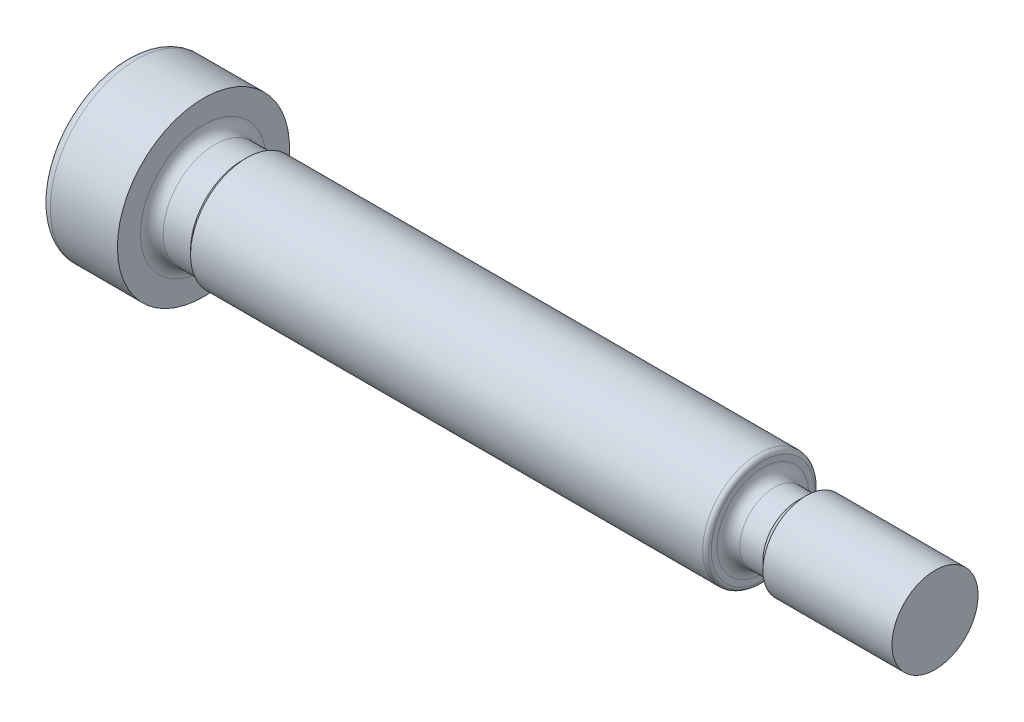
SolidWorks part; units mm, degrees
ref_plane "Front Plane" through (0, 0, 0) normal (0, 0, 1) x (1, 0, 0)
ref_plane "Top Plane" through (0, 0, 0) normal (0, 1, 0) x (1, 0, 0)
ref_plane "Right Plane" through (0, 0, 0) normal (1, 0, 0) x (0, 0, -1)
sketch "Sketch1" plane through (0, 0, 0) normal (0, 0, 1) x (1, 0, 0)
  line L0 (-180.4629, 0) -> (8842.6818, 0) construction
  line L1 (0, -180.4629) -> (0, 8842.6818) construction
  line L2 (0, 0) -> (0, 5)
  line L3 (0, 5) -> (4.5, 5)
  line L4 (4.5, 5) -> (4.5, 3)
  line L5 (0, 0) -> (47, 0)
  line L6 (4.5, 3) -> (6.75, 3)
  line L7 (6.75, 3) -> (7, 3.25)
  line L8 (7, 3.25) -> (37, 3.25)
  line L9 (37, 3.25) -> (37, 2)
  line L11 (37, 2) -> (39, 2)
  line L12 (39, 2) -> (39.5, 2.5)
  line L13 (39.5, 2.5) -> (47, 2.5)
  line L14 (47, 2.5) -> (47, 0)
  dimension "D1" = 5
  dimension "D2" = 6.5
  dimension "D3" = 10
  dimension "D4" = 4.5
  dimension "D5" = 10
  dimension "D6" = 6
  dimension "D7" = 2.5
  dimension "D8" = 135
  dimension "D9" = 2.5
  dimension "D10" = 4
  dimension "D11" = 30
revolve "Revolve1" add sketch "Sketch1" angle 360 about L5
fillet "Fillet1" radius 0.66 2 edges at (37, 0, 2) (4.5, 0, 3)
fillet "Fillet3" radius 0.6 1 edges at (0, 0, 5)
sketch "Sketch2" plane through (0, 0, 0) normal (-1, 0, 0) x (0, 0, 1)
  line L1 (-1.7321, 0) -> (-0.866, -1.5)
  line L2 (-0.866, -1.5) -> (0.866, -1.5)
  line L3 (0.866, -1.5) -> (1.7321, 0)
  line L4 (1.7321, 0) -> (0.866, 1.5)
  line L5 (0.866, 1.5) -> (-0.866, 1.5)
  line L6 (-0.866, 1.5) -> (-1.7321, 0)
  circle A0 centre (0, 0) radius 1.5 construction
  dimension "D1" = 3
extrude "Cut-Extrude1" cut sketch "Sketch2" against normal blind 3.5
fillet "Fillet4" radius 0.25 1 edges at (37, 0, 3.25)
